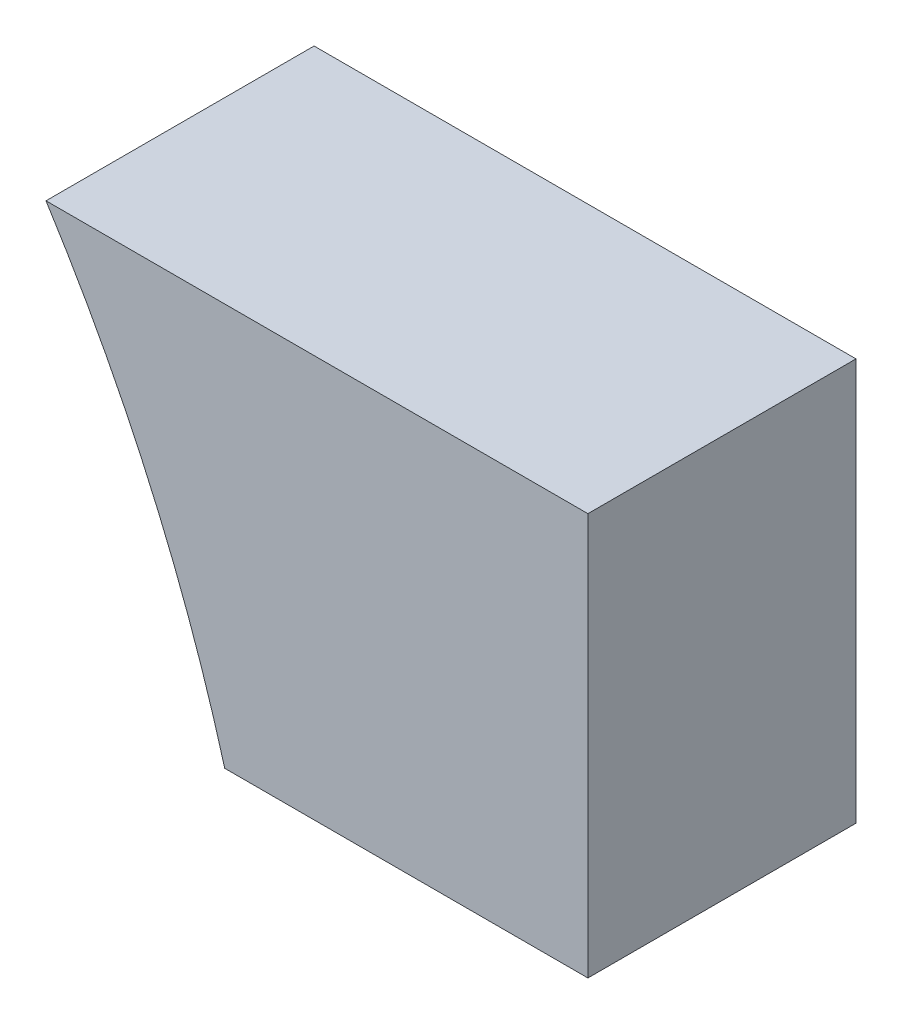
SolidWorks part; units mm, degrees
ref_plane "Plan de face" through (0, 0, 0) normal (0, 0, 1) x (1, 0, 0)
ref_plane "Plan de dessus" through (0, 0, 0) normal (0, 1, 0) x (1, 0, 0)
ref_plane "Plan de droite" through (0, 0, 0) normal (1, 0, 0) x (0, 0, -1)
sketch "Esquisse1" plane through (0, 0, 0) normal (0, 0, 1) x (1, 0, 0)
  line L0 (0, 0) -> (470.6608, 0) construction
  line L1 (0, -55.3377) -> (0, 353.7921) construction
  line L2 (0, 0) -> (442.2765, 160.9755) construction
  line L3 (0, 0) -> (360.5471, 302.5349) construction
  line L4 (0, 0) -> (235.3304, 407.6042) construction
  line L5 (0, 0) -> (81.7294, 463.5104) construction
  line L6 (0, 0) -> (-81.7294, 463.5104) construction
  line L7 (0, 0) -> (-235.3304, 407.6042) construction
  line L8 (0, 0) -> (-360.5471, 302.5349) construction
  line L9 (0, 0) -> (-442.2765, 160.9755) construction
  line L10 (0, 0) -> (-470.6608, 0) construction
  line L11 (-390.3547, -30) -> (366.2536, -30) construction
  line L12 (-390.3547, 30) -> (366.2536, 30) construction
  line L13 (-390.3547, 60) -> (366.2536, 60) construction
  line L14 (22.5, -55.3377) -> (22.5, 160.9755) construction
  line L15 (366.2536, 90) -> (-390.3547, 90) construction
  line L16 (45, -55.3377) -> (45, 160.9755) construction
  line L17 (-390.3547, 120) -> (366.2536, 120) construction
  line L18 (-90, -59.8279) -> (-90, 0) construction
  line L19 (366.2536, 150) -> (-390.3547, 150) construction
  line L20 (67.5, -55.3377) -> (67.5, 160.9755) construction
  line L21 (90, -55.3377) -> (90, 160.9755) construction
  line L22 (112.5, -55.3377) -> (112.5, 160.9755) construction
  line L23 (135, -55.3377) -> (135, 160.9755) construction
  line L24 (157.5, -55.3377) -> (157.5, 160.9755) construction
  line L25 (180, -55.3377) -> (180, 160.9755) construction
  line L26 (202.5, -55.3377) -> (202.5, 160.9755) construction
  line L27 (225, -55.3377) -> (225, 160.9755) construction
  line L28 (94.5727, 60) -> (135, 60)
  line L29 (135, 60) -> (135, 30)
  line L30 (135, 30) -> (107.9074, 30)
  arc A0 (90, 0) -> (-90, 0) centre (0, 0) ccw construction
  arc A1 (112, 0) -> (-112, 0) centre (0, 0) ccw construction
  arc A2 (107.9074, 30) -> (94.5727, 60) centre (0, 0) ccw
extrude "Extrusion1" add sketch "Esquisse1" along normal blind 20
